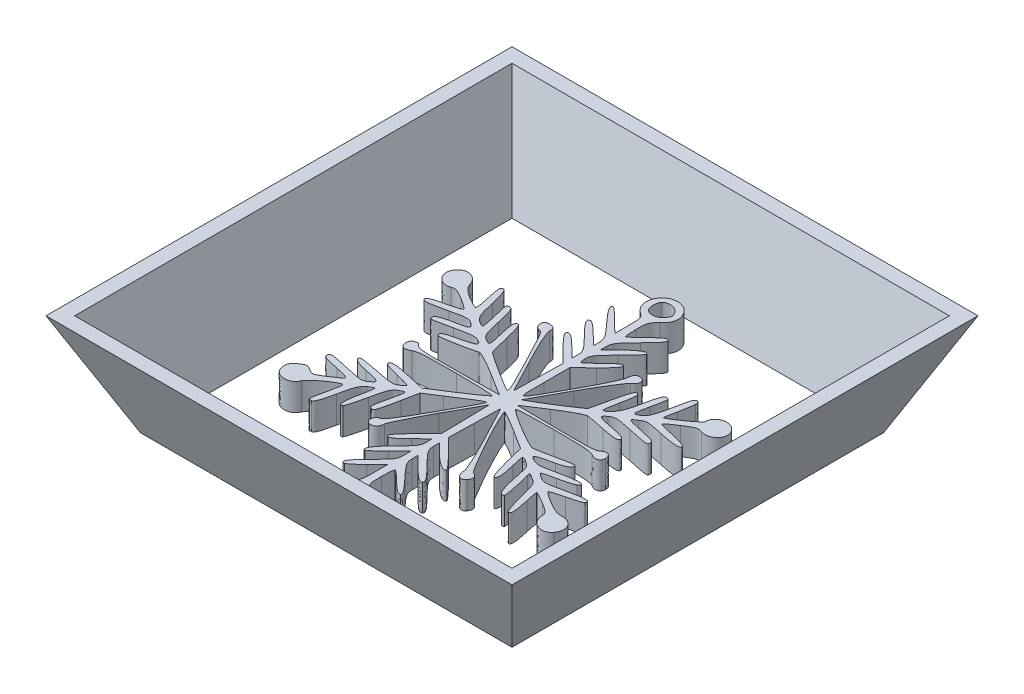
SolidWorks part; units mm, degrees
ref_plane "Front Plane" through (0, 0, 0) normal (0, 0, 1) x (1, 0, 0)
ref_plane "Top Plane" through (0, 0, 0) normal (0, 1, 0) x (1, 0, 0)
ref_plane "Right Plane" through (0, 0, 0) normal (1, 0, 0) x (0, 0, -1)
sketch "Sketch1" plane through (0, 0, 0) normal (0, 1, 0) x (1, 0, 0)
  line L0 (-0.3822, -18.6221) -> (-0.3822, -16.6296)
  line L1 (-0.3822, -16.6296) -> (-1.9112, -18.1427)
  line L2 (-0.3822, -14.2466) -> (-0.3822, -13.1888)
  line L3 (-0.3822, -13.1888) -> (-2.043, -14.8348)
  line L4 (-0.3822, -10.9399) -> (-0.3822, -10.0151)
  line L5 (-0.3822, -10.0151) -> (-1.9112, -11.5281)
  line L6 (-2.2265, -10.5198) -> (-0.3666, -8.6474)
  line L7 (-0.3666, -8.6474) -> (-0.4406, -5.0418)
  line L8 (-0.4406, -5.0418) -> (-0.5145, -1.4363)
  line L9 (-0.5145, -1.4363) -> (-3.1603, -6.2207)
  line L10 (-5.0198, -3.6827) -> (-7.1438, -5.0604)
  line L11 (-7.1438, -5.0604) -> (-7.6164, -7.3971)
  line L12 (-9.9073, -3.7762) -> (-7.6583, -4.2872)
  line L13 (-7.6583, -4.2872) -> (-4.6231, -2.3366)
  line L14 (-6.9447, 0.5136) -> (-1.0441, 0.5848)
  line L15 (-1.0441, 0.5848) -> (-4.3341, 2.6375)
  line L16 (-3.0173, 6.9386) -> (-0.5145, 2.1799)
  line L17 (-0.5145, 2.1799) -> (-0.4403, 5.7336)
  line L18 (-0.4403, 5.7336) -> (-0.3661, 9.2874)
  line L19 (-0.3661, 9.2874) -> (-2.2262, 11.16)
  line L20 (-1.9112, 12.1686) -> (-0.3822, 10.6555)
  line L21 (-0.3822, 10.6555) -> (-0.3822, 11.5803)
  line L22 (-1.9112, 15.3436) -> (-0.3822, 13.8305)
  line L23 (-0.3822, 13.8305) -> (-0.3862, 14.7483)
  line L24 (-2.043, 18.6502) -> (-0.3822, 17.0042)
  line L25 (-0.3822, 17.0042) -> (-0.3822, 18.9973)
  line L26 (0.6761, 14.7424) -> (0.6761, 13.8305)
  line L27 (0.6761, 13.8305) -> (2.2052, 15.3436)
  line L28 (2.6819, 11.2483) -> (0.6761, 9.2811)
  line L29 (0.6761, 9.2811) -> (0.6761, 5.4694)
  line L30 (4.5784, 2.503) -> (1.6095, 0.5848)
  line L31 (1.6095, 0.5848) -> (7.4, 0.5134)
  line L32 (8.0776, -7.477) -> (7.4094, -4.7314)
  line L33 (7.4094, -4.7314) -> (4.5403, -2.9206)
  line L34 (3.4446, -6.0571) -> (0.8084, -1.0575)
  line L35 (0.8084, -1.0575) -> (0.7347, -4.8531)
  line L36 (0.7347, -4.8531) -> (0.661, -8.6486)
  line L37 (0.661, -8.6486) -> (2.653, -10.6523)
  line L38 (2.2052, -11.5281) -> (0.6762, -10.0151)
  line L39 (0.6762, -10.0151) -> (0.6762, -10.927)
  line L40 (2.3932, -14.8905) -> (0.6762, -13.1888)
  line L41 (0.6762, -13.1888) -> (0.6812, -14.1072)
  spline S0 degree 3 poles (-0.941, -25.0906) (-2.4269, -24.2599) (-2.5331, -22.2048) (-1.1432, -21.1772) knots 0 0 0 0 1 1 1 1
  spline S1 degree 3 poles (-1.1432, -21.1772) (-0.4221, -20.6441) (-0.3822, -20.5101) (-0.3822, -18.6221) knots 0 0 0 0 1 1 1 1
  spline S2 degree 3 poles (-1.9112, -18.1427) (-2.7522, -18.9749) (-3.5856, -19.6558) (-3.7633, -19.6558) knots 0 0 0 0 1 1 1 1
  spline S3 degree 3 poles (-3.7633, -19.6558) (-4.4651, -19.6558) (-4.0049, -18.8993) (-2.2343, -17.1422) knots 0 0 0 0 1 1 1 1
  spline S4 degree 3 poles (-2.2343, -17.1422) (-0.5565, -15.4774) (-0.3822, -15.2048) (-0.3822, -14.2466) knots 0 0 0 0 1 1 1 1
  spline S5 degree 3 poles (-2.043, -14.8348) (-2.9564, -15.7401) (-3.7898, -16.4808) (-3.8951, -16.4808) knots 0 0 0 0 1 1 1 1
  spline S6 degree 3 poles (-3.8951, -16.4808) (-4.5456, -16.4808) (-3.8336, -15.2897) (-2.2343, -13.7027) knots 0 0 0 0 1 1 1 1
  spline S7 degree 3 poles (-2.2343, -13.7027) (-0.645, -12.1255) (-0.3822, -11.7336) (-0.3822, -10.9399) knots 0 0 0 0 1 1 1 1
  spline S8 degree 3 poles (-1.9112, -11.5281) (-3.4006, -13.0019) (-4.0864, -13.3767) (-4.0864, -12.7167) knots 0 0 0 0 1 1 1 1
  spline S9 degree 3 poles (-4.0864, -12.7167) (-4.0864, -12.5382) (-3.2494, -11.5496) (-2.2265, -10.5198) knots 0 0 0 0 1 1 1 1
  spline S10 degree 3 poles (-3.1603, -6.2207) (-4.6155, -8.8521) (-5.8062, -11.3008) (-5.8062, -11.6622) knots 0 0 0 0 1 1 1 1
  spline S11 degree 3 poles (-5.8062, -11.6622) (-5.8062, -12.4243) (-6.4599, -12.9377) (-7.1117, -12.6876) knots 0 0 0 0 1 1 1 1
  spline S12 degree 3 poles (-7.1117, -12.6876) (-7.7384, -12.4471) (-7.5495, -11.344) (-6.8645, -11.2446) knots 0 0 0 0 1 1 1 1
  spline S13 degree 3 poles (-6.8645, -11.2446) (-6.4826, -11.1891) (-5.6357, -9.9045) (-3.8218, -6.6293) knots 0 0 0 0 1 1 1 1
  spline S14 degree 3 poles (-3.8218, -6.6293) (-2.4393, -4.1332) (-1.2193, -1.8664) (-1.1105, -1.5918) knots 0 0 0 0 1 1 1 1
  spline S15 degree 3 poles (-1.1105, -1.5918) (-0.8854, -1.0236) (-1.0835, -1.1296) (-5.0198, -3.6827) knots 0 0 0 0 1 1 1 1
  spline S16 degree 3 poles (-7.6164, -7.3971) (-8.2481, -10.5206) (-8.2959, -10.6599) (-8.7344, -10.6599) knots 0 0 0 0 1 1 1 1
  spline S17 degree 3 poles (-8.7344, -10.6599) (-9.2044, -10.6599) (-9.1998, -10.1697) (-8.7113, -8.1464) knots 0 0 0 0 1 1 1 1
  spline S18 degree 3 poles (-8.7113, -8.1464) (-8.1622, -5.8722) (-8.1801, -5.785) (-9.0858, -6.3201) knots 0 0 0 0 1 1 1 1
  spline S19 degree 3 poles (-9.0858, -6.3201) (-9.7703, -6.7244) (-9.9123, -7.0565) (-10.4203, -9.4422) knots 0 0 0 0 1 1 1 1
  spline S20 degree 3 poles (-10.4203, -9.4422) (-10.7329, -10.9105) (-11.0987, -12.2218) (-11.2331, -12.3562) knots 0 0 0 0 1 1 1 1
  spline S21 degree 3 poles (-11.2331, -12.3562) (-11.7346, -12.8578) (-11.8218, -11.633) (-11.4161, -9.7841) knots 0 0 0 0 1 1 1 1
  spline S22 degree 3 poles (-11.4161, -9.7841) (-11.1876, -8.7428) (-11.0543, -7.8372) (-11.1197, -7.7717) knots 0 0 0 0 1 1 1 1
  spline S23 degree 3 poles (-11.1197, -7.7717) (-11.1852, -7.7062) (-11.5585, -7.8913) (-11.9492, -8.183) knots 0 0 0 0 1 1 1 1
  spline S24 degree 3 poles (-11.9492, -8.183) (-12.5441, -8.6272) (-12.7492, -9.1398) (-13.2117, -11.3386) knots 0 0 0 0 1 1 1 1
  spline S25 degree 3 poles (-13.2117, -11.3386) (-13.6306, -13.3299) (-13.8734, -13.985) (-14.2169, -14.0511) knots 0 0 0 0 1 1 1 1
  spline S26 degree 3 poles (-14.2169, -14.0511) (-14.7724, -14.1581) (-14.7731, -14.0928) (-14.2413, -11.7382) knots 0 0 0 0 1 1 1 1
  spline S27 degree 3 poles (-14.2413, -11.7382) (-14.0057, -10.6948) (-13.8747, -9.7793) (-13.9502, -9.7038) knots 0 0 0 0 1 1 1 1
  spline S28 degree 3 poles (-13.9502, -9.7038) (-14.2546, -9.3994) (-17.237, -11.5529) (-17.5091, -12.2736) knots 0 0 0 0 1 1 1 1
  spline S29 degree 3 poles (-17.5091, -12.2736) (-18.032, -13.659) (-20.2859, -13.552) (-20.6441, -12.1247) knots 0 0 0 0 1 1 1 1
  spline S30 degree 3 poles (-20.6441, -12.1247) (-20.8661, -11.2403) (-20.6674, -10.788) (-19.8104, -10.2264) knots 0 0 0 0 1 1 1 1
  spline S31 degree 3 poles (-19.8104, -10.2264) (-19.1374, -9.7855) (-19.0615, -9.7852) (-18.3032, -10.2205) knots 0 0 0 0 1 1 1 1
  spline S32 degree 3 poles (-18.3032, -10.2205) (-17.5062, -10.6778) (-17.5013, -10.6766) (-15.8996, -9.624) knots 0 0 0 0 1 1 1 1
  spline S33 degree 3 poles (-15.8996, -9.624) (-14.1745, -8.4904) (-14.1667, -8.5105) (-16.5219, -8.0116) knots 0 0 0 0 1 1 1 1
  spline S34 degree 3 poles (-16.5219, -8.0116) (-18.7433, -7.541) (-18.9031, -7.4779) (-18.9031, -7.0703) knots 0 0 0 0 1 1 1 1
  spline S35 degree 3 poles (-18.9031, -7.0703) (-18.9031, -6.5739) (-18.7026, -6.5856) (-15.6771, -7.2592) knots 0 0 0 0 1 1 1 1
  spline S36 degree 3 poles (-15.6771, -7.2592) (-13.2125, -7.808) (-13.0848, -7.8121) (-12.4011, -7.3641) knots 0 0 0 0 1 1 1 1
  spline S37 degree 3 poles (-12.4011, -7.3641) (-11.5117, -6.7814) (-11.7832, -6.5819) (-14.0473, -6.1547) knots 0 0 0 0 1 1 1 1
  spline S38 degree 3 poles (-14.0473, -6.1547) (-15.6309, -5.8559) (-16.5593, -5.3216) (-16.0461, -5.0045) knots 0 0 0 0 1 1 1 1
  spline S39 degree 3 poles (-16.0461, -5.0045) (-15.9158, -4.9239) (-14.6012, -5.1125) (-13.1247, -5.4235) knots 0 0 0 0 1 1 1 1
  spline S40 degree 3 poles (-13.1247, -5.4235) (-10.814, -5.9101) (-10.3477, -5.9394) (-9.7768, -5.6339) knots 0 0 0 0 1 1 1 1
  spline S41 degree 3 poles (-9.7768, -5.6339) (-9.412, -5.4386) (-9.1135, -5.1858) (-9.1135, -5.0719) knots 0 0 0 0 1 1 1 1
  spline S42 degree 3 poles (-9.1135, -5.0719) (-9.1135, -4.9581) (-10.066, -4.6603) (-11.2302, -4.4101) knots 0 0 0 0 1 1 1 1
  spline S43 degree 3 poles (-11.2302, -4.4101) (-12.5867, -4.1186) (-13.3469, -3.8289) (-13.3469, -3.6035) knots 0 0 0 0 1 1 1 1
  spline S44 degree 3 poles (-13.3469, -3.6035) (-13.3469, -3.1304) (-12.5803, -3.1689) (-9.9073, -3.7762) knots 0 0 0 0 1 1 1 1
  spline S45 degree 3 poles (-4.6231, -2.3366) (-2.9537, -1.2639) (-1.5467, -0.2626) (-1.4964, -0.1116) knots 0 0 0 0 1 1 1 1
  spline S46 degree 3 poles (-1.4964, -0.1116) (-1.435, 0.0721) (-3.2551, 0.1637) (-7.0035, 0.1654) knots 0 0 0 0 1 1 1 1
  spline S47 degree 3 poles (-7.0035, 0.1654) (-11.5126, 0.1674) (-12.7188, 0.0915) (-13.2018, -0.2249) knots 0 0 0 0 1 1 1 1
  spline S48 degree 3 poles (-13.2018, -0.2249) (-13.5316, -0.441) (-13.9968, -0.5428) (-14.2356, -0.4512) knots 0 0 0 0 1 1 1 1
  spline S49 degree 3 poles (-14.2356, -0.4512) (-14.7903, -0.2384) (-14.8017, 0.8744) (-14.2512, 1.0857) knots 0 0 0 0 1 1 1 1
  spline S50 degree 3 poles (-14.2512, 1.0857) (-13.6921, 1.3002) (-13.7066, 1.3037) (-13.2472, 0.8443) knots 0 0 0 0 1 1 1 1
  spline S51 degree 3 poles (-13.2472, 0.8443) (-12.9072, 0.5043) (-11.9361, 0.4533) (-6.9447, 0.5136) knots 0 0 0 0 1 1 1 1
  spline S52 degree 3 poles (-4.3341, 2.6375) (-6.1437, 3.7666) (-7.8104, 4.634) (-8.0381, 4.5652) knots 0 0 0 0 1 1 1 1
  spline S53 degree 3 poles (-8.0381, 4.5652) (-9.7231, 4.0559) (-13.1125, 3.4625) (-13.232, 3.6558) knots 0 0 0 0 1 1 1 1
  spline S54 degree 3 poles (-13.232, 3.6558) (-13.5202, 4.1221) (-13.0534, 4.3745) (-11.0988, 4.8094) knots 0 0 0 0 1 1 1 1
  spline S55 degree 3 poles (-11.0988, 4.8094) (-8.9999, 5.2763) (-8.6946, 5.5646) (-9.7768, 6.0577) knots 0 0 0 0 1 1 1 1
  spline S56 degree 3 poles (-9.7768, 6.0577) (-10.3069, 6.2992) (-10.958, 6.2446) (-13.0179, 5.786) knots 0 0 0 0 1 1 1 1
  spline S57 degree 3 poles (-13.0179, 5.786) (-16.0709, 5.1062) (-15.9927, 5.111) (-15.9927, 5.6017) knots 0 0 0 0 1 1 1 1
  spline S58 degree 3 poles (-15.9927, 5.6017) (-15.9927, 5.9815) (-15.0784, 6.3137) (-13.0132, 6.684) knots 0 0 0 0 1 1 1 1
  spline S59 degree 3 poles (-13.0132, 6.684) (-11.7378, 6.9127) (-11.5986, 7.1654) (-12.4429, 7.7187) knots 0 0 0 0 1 1 1 1
  spline S60 degree 3 poles (-12.4429, 7.7187) (-13.0837, 8.1385) (-13.2563, 8.1327) (-15.5033, 7.6154) knots 0 0 0 0 1 1 1 1
  spline S61 degree 3 poles (-15.5033, 7.6154) (-18.2942, 6.9728) (-18.9031, 6.9388) (-18.9031, 7.4257) knots 0 0 0 0 1 1 1 1
  spline S62 degree 3 poles (-18.9031, 7.4257) (-18.9031, 7.6594) (-18.1661, 7.9435) (-16.7864, 8.2416) knots 0 0 0 0 1 1 1 1
  spline S63 degree 3 poles (-16.7864, 8.2416) (-15.6222, 8.4931) (-14.6697, 8.7994) (-14.6697, 8.9222) knots 0 0 0 0 1 1 1 1
  spline S64 degree 3 poles (-14.6697, 8.9222) (-14.6697, 9.045) (-15.3724, 9.5722) (-16.2312, 10.094) knots 0 0 0 0 1 1 1 1
  spline S65 degree 3 poles (-16.2312, 10.094) (-17.5101, 10.8708) (-17.9098, 10.9979) (-18.4401, 10.7963) knots 0 0 0 0 1 1 1 1
  spline S66 degree 3 poles (-18.4401, 10.7963) (-19.9141, 10.2359) (-21.2641, 11.9393) (-20.396, 13.2643) knots 0 0 0 0 1 1 1 1
  spline S67 degree 3 poles (-20.396, 13.2643) (-19.5935, 14.4891) (-17.7739, 14.0482) (-17.3681, 12.5306) knots 0 0 0 0 1 1 1 1
  spline S68 degree 3 poles (-17.3681, 12.5306) (-17.2267, 12.0019) (-16.7142, 11.4962) (-15.6507, 10.836) knots 0 0 0 0 1 1 1 1
  spline S69 degree 3 poles (-15.6507, 10.836) (-14.817, 10.3185) (-14.0707, 9.9591) (-13.9924, 10.0374) knots 0 0 0 0 1 1 1 1
  spline S70 degree 3 poles (-13.9924, 10.0374) (-13.9141, 10.1157) (-14.0344, 10.9751) (-14.2599, 11.9472) knots 0 0 0 0 1 1 1 1
  spline S71 degree 3 poles (-14.2599, 11.9472) (-14.7649, 14.1248) (-14.77, 14.4754) (-14.2966, 14.4754) knots 0 0 0 0 1 1 1 1
  spline S72 degree 3 poles (-14.2966, 14.4754) (-14.0407, 14.4754) (-13.729, 13.6322) (-13.3044, 11.7915) knots 0 0 0 0 1 1 1 1
  spline S73 degree 3 poles (-13.3044, 11.7915) (-12.7892, 9.5577) (-12.564, 9.017) (-11.9621, 8.568) knots 0 0 0 0 1 1 1 1
  spline S74 degree 3 poles (-11.9621, 8.568) (-11.5642, 8.2713) (-11.1821, 8.0852) (-11.1129, 8.1544) knots 0 0 0 0 1 1 1 1
  spline S75 degree 3 poles (-11.1129, 8.1544) (-11.0437, 8.2236) (-11.1486, 8.93) (-11.346, 9.7242) knots 0 0 0 0 1 1 1 1
  spline S76 degree 3 poles (-11.346, 9.7242) (-12.0769, 12.6647) (-12.0739, 12.6233) (-11.5497, 12.6233) knots 0 0 0 0 1 1 1 1
  spline S77 degree 3 poles (-11.5497, 12.6233) (-11.1508, 12.6233) (-10.9583, 12.1409) (-10.4577, 9.8853) knots 0 0 0 0 1 1 1 1
  spline S78 degree 3 poles (-10.4577, 9.8853) (-9.9161, 7.4453) (-9.7667, 7.0982) (-9.0848, 6.6954) knots 0 0 0 0 1 1 1 1
  spline S79 degree 3 poles (-9.0848, 6.6954) (-8.1844, 6.1635) (-8.1699, 6.2365) (-8.7219, 8.5223) knots 0 0 0 0 1 1 1 1
  spline S80 degree 3 poles (-8.7219, 8.5223) (-9.2038, 10.5182) (-9.2086, 11.0358) (-8.7454, 11.0358) knots 0 0 0 0 1 1 1 1
  spline S81 degree 3 poles (-8.7454, 11.0358) (-8.4959, 11.0358) (-8.186, 10.1913) (-7.7826, 8.4121) knots 0 0 0 0 1 1 1 1
  spline S82 degree 3 poles (-7.7826, 8.4121) (-7.4554, 6.9691) (-7.115, 5.6777) (-7.0261, 5.5423) knots 0 0 0 0 1 1 1 1
  spline S83 degree 3 poles (-7.0261, 5.5423) (-6.874, 5.3105) (-2.3851, 2.4225) (-1.1471, 1.76) knots 0 0 0 0 1 1 1 1
  spline S84 degree 3 poles (-1.1471, 1.76) (-0.713, 1.5276) (-1.1645, 2.5838) (-3.0364, 6.1791) knots 0 0 0 0 1 1 1 1
  spline S85 degree 3 poles (-3.0364, 6.1791) (-5.9549, 11.7846) (-5.9814, 11.8296) (-6.3666, 11.8296) knots 0 0 0 0 1 1 1 1
  spline S86 degree 3 poles (-6.3666, 11.8296) (-6.8526, 11.8296) (-7.2846, 12.5196) (-7.0999, 13.001) knots 0 0 0 0 1 1 1 1
  spline S87 degree 3 poles (-7.0999, 13.001) (-6.9871, 13.2948) (-6.6939, 13.4184) (-6.2354, 13.3652) knots 0 0 0 0 1 1 1 1
  spline S88 degree 3 poles (-6.2354, 13.3652) (-5.6617, 13.2987) (-5.5397, 13.1473) (-5.5308, 12.491) knots 0 0 0 0 1 1 1 1
  spline S89 degree 3 poles (-5.5308, 12.491) (-5.5249, 12.0162) (-4.5146, 9.7855) (-3.0173, 6.9386) knots 0 0 0 0 1 1 1 1
  spline S90 degree 3 poles (-2.2262, 11.16) (-3.2493, 12.1899) (-4.0864, 13.1787) (-4.0864, 13.3571) knots 0 0 0 0 1 1 1 1
  spline S91 degree 3 poles (-4.0864, 13.3571) (-4.0864, 14.0171) (-3.4005, 13.6423) (-1.9112, 12.1686) knots 0 0 0 0 1 1 1 1
  spline S92 degree 3 poles (-0.3822, 11.5803) (-0.3822, 12.374) (-0.645, 12.766) (-2.2343, 14.3431) knots 0 0 0 0 1 1 1 1
  spline S93 degree 3 poles (-2.2343, 14.3431) (-4.0049, 16.1002) (-4.4651, 16.8566) (-3.7633, 16.8566) knots 0 0 0 0 1 1 1 1
  spline S94 degree 3 poles (-3.7633, 16.8566) (-3.5856, 16.8566) (-2.7522, 16.1758) (-1.9112, 15.3436) knots 0 0 0 0 1 1 1 1
  spline S95 degree 3 poles (-0.3862, 14.7483) (-0.3892, 15.5155) (-0.6927, 15.9915) (-2.2343, 17.6504) knots 0 0 0 0 1 1 1 1
  spline S96 degree 3 poles (-2.2343, 17.6504) (-3.8968, 19.4393) (-4.4347, 20.2962) (-3.8951, 20.2962) knots 0 0 0 0 1 1 1 1
  spline S97 degree 3 poles (-3.8951, 20.2962) (-3.7898, 20.2962) (-2.9564, 19.5555) (-2.043, 18.6502) knots 0 0 0 0 1 1 1 1
  spline S98 degree 3 poles (-0.3822, 18.9973) (-0.3822, 20.8919) (-0.4203, 21.0187) (-1.1529, 21.5603) knots 0 0 0 0 1 1 1 1
  spline S99 degree 3 poles (-1.1529, 21.5603) (-2.121, 22.276) (-2.4045, 23.433) (-1.8667, 24.473) knots 0 0 0 0 1 1 1 1
  spline S100 degree 3 poles (-1.8667, 24.473) (-1.0838, 25.9868) (0.9567, 26.1914) (2.0032, 24.861) knots 0 0 0 0 1 1 1 1
  spline S101 degree 3 poles (2.0032, 24.861) (2.8204, 23.8222) (2.6834, 22.754) (1.6022, 21.7343) knots 0 0 0 0 1 1 1 1
  spline S102 degree 3 poles (1.6022, 21.7343) (0.7265, 20.9084) (0.6761, 20.7664) (0.6761, 19.1234) knots 0 0 0 0 1 1 1 1
  spline S103 degree 3 poles (0.6761, 19.1234) (0.6761, 18.1677) (0.762, 17.3858) (0.8669, 17.3858) knots 0 0 0 0 1 1 1 1
  spline S104 degree 3 poles (0.8669, 17.3858) (0.9718, 17.3858) (1.7446, 18.0656) (2.5842, 18.8964) knots 0 0 0 0 1 1 1 1
  spline S105 degree 3 poles (2.5842, 18.8964) (3.7872, 20.0869) (4.1793, 20.3385) (4.4342, 20.0835) knots 0 0 0 0 1 1 1 1
  spline S106 degree 3 poles (4.4342, 20.0835) (4.6892, 19.8286) (4.3253, 19.325) (2.7169, 17.7072) knots 0 0 0 0 1 1 1 1
  spline S107 degree 3 poles (2.7169, 17.7072) (0.9641, 15.944) (0.6761, 15.5256) (0.6761, 14.7424) knots 0 0 0 0 1 1 1 1
  spline S108 degree 3 poles (2.2052, 15.3436) (3.5521, 16.6764) (4.6449, 17.2623) (4.6449, 16.6516) knots 0 0 0 0 1 1 1 1
  spline S109 degree 3 poles (4.6449, 16.6516) (4.6449, 16.5388) (3.7519, 15.5595) (2.6605, 14.4754) knots 0 0 0 0 1 1 1 1
  spline S110 degree 3 poles (2.6605, 14.4754) (0.9962, 12.8222) (0.6761, 12.3645) (0.6761, 11.6377) knots 0 0 0 0 1 1 1 1
  spline S111 degree 3 poles (0.6761, 11.6377) (0.6761, 11.1612) (0.762, 10.7712) (0.8669, 10.7712) knots 0 0 0 0 1 1 1 1
  spline S112 degree 3 poles (0.8669, 10.7712) (0.9718, 10.7712) (1.7446, 11.451) (2.5842, 12.2818) knots 0 0 0 0 1 1 1 1
  spline S113 degree 3 poles (2.5842, 12.2818) (3.6863, 13.3724) (4.1909, 13.7122) (4.3992, 13.5039) knots 0 0 0 0 1 1 1 1
  spline S114 degree 3 poles (4.3992, 13.5039) (4.6075, 13.2957) (4.13, 12.6685) (2.6819, 11.2483) knots 0 0 0 0 1 1 1 1
  spline S115 degree 3 poles (0.6761, 5.4694) (0.6761, 1.033) (0.3697, 0.8857) (3.7251, 6.9348) knots 0 0 0 0 1 1 1 1
  spline S116 degree 3 poles (3.7251, 6.9348) (5.1304, 9.4682) (6.1319, 11.5931) (6.219, 12.2264) knots 0 0 0 0 1 1 1 1
  spline S117 degree 3 poles (6.219, 12.2264) (6.3448, 13.1401) (6.4551, 13.2848) (7.0261, 13.2848) knots 0 0 0 0 1 1 1 1
  spline S118 degree 3 poles (7.0261, 13.2848) (7.947, 13.2848) (8.0651, 12.3156) (7.2122, 11.7568) knots 0 0 0 0 1 1 1 1
  spline S119 degree 3 poles (7.2122, 11.7568) (6.8554, 11.5231) (5.4431, 9.2779) (3.9836, 6.6245) knots 0 0 0 0 1 1 1 1
  spline S120 degree 3 poles (3.9836, 6.6245) (2.5567, 4.0302) (1.3267, 1.7957) (1.2504, 1.6587) knots 0 0 0 0 1 1 1 1
  spline S121 degree 3 poles (1.2504, 1.6587) (1.0807, 1.3543) (5.7659, 4.2454) (7.2304, 5.3488) knots 0 0 0 0 1 1 1 1
  spline S122 degree 3 poles (7.2304, 5.3488) (7.27, 5.3786) (7.5518, 6.5811) (7.8568, 8.0209) knots 0 0 0 0 1 1 1 1
  spline S123 degree 3 poles (7.8568, 8.0209) (8.432, 10.7374) (8.6934, 11.3268) (9.1291, 10.8903) knots 0 0 0 0 1 1 1 1
  spline S124 degree 3 poles (9.1291, 10.8903) (9.2873, 10.7318) (9.2001, 9.8322) (8.8932, 8.4561) knots 0 0 0 0 1 1 1 1
  spline S125 degree 3 poles (8.8932, 8.4561) (8.6254, 7.2556) (8.5059, 6.2733) (8.6275, 6.2733) knots 0 0 0 0 1 1 1 1
  spline S126 degree 3 poles (8.6275, 6.2733) (9.297, 6.2733) (10.1558, 7.581) (10.4521, 9.0514) knots 0 0 0 0 1 1 1 1
  spline S127 degree 3 poles (10.4521, 9.0514) (11.0302, 11.9204) (11.2691, 12.6233) (11.6665, 12.6233) knots 0 0 0 0 1 1 1 1
  spline S128 degree 3 poles (11.6665, 12.6233) (12.1506, 12.6233) (12.1485, 12.4854) (11.6308, 10.2095) knots 0 0 0 0 1 1 1 1
  spline S129 degree 3 poles (11.6308, 10.2095) (11.3986, 9.1882) (11.2758, 8.2854) (11.358, 8.2032) knots 0 0 0 0 1 1 1 1
  spline S130 degree 3 poles (11.358, 8.2032) (11.4402, 8.121) (11.7956, 8.2425) (12.1477, 8.4732) knots 0 0 0 0 1 1 1 1
  spline S131 degree 3 poles (12.1477, 8.4732) (12.7653, 8.8779) (13.0645, 9.8066) (13.8044, 13.6155) knots 0 0 0 0 1 1 1 1
  spline S132 degree 3 poles (13.8044, 13.6155) (13.993, 14.5867) (14.7041, 14.7992) (14.6897, 13.8801) knots 0 0 0 0 1 1 1 1
  spline S133 degree 3 poles (14.6897, 13.8801) (14.6847, 13.5527) (14.5148, 12.512) (14.3123, 11.5675) knots 0 0 0 0 1 1 1 1
  spline S134 degree 3 poles (14.3123, 11.5675) (14.1099, 10.623) (13.9679, 9.8267) (13.9967, 9.7978) knots 0 0 0 0 1 1 1 1
  spline S135 degree 3 poles (13.9967, 9.7978) (14.1875, 9.607) (17.6094, 12.0368) (17.6094, 12.3631) knots 0 0 0 0 1 1 1 1
  spline S136 degree 3 poles (17.6094, 12.3631) (17.6094, 13.7742) (19.4839, 14.453) (20.5198, 13.4171) knots 0 0 0 0 1 1 1 1
  spline S137 degree 3 poles (20.5198, 13.4171) (21.8116, 12.1253) (20.3883, 10.2111) (18.5997, 10.8346) knots 0 0 0 0 1 1 1 1
  spline S138 degree 3 poles (18.5997, 10.8346) (17.9691, 11.0544) (17.648, 10.9484) (16.2855, 10.0706) knots 0 0 0 0 1 1 1 1
  spline S139 degree 3 poles (16.2855, 10.0706) (15.4155, 9.5101) (14.7026, 8.9824) (14.7013, 8.8981) knots 0 0 0 0 1 1 1 1
  spline S140 degree 3 poles (14.7013, 8.8981) (14.7003, 8.8136) (15.6475, 8.5409) (16.8068, 8.2917) knots 0 0 0 0 1 1 1 1
  spline S141 degree 3 poles (16.8068, 8.2917) (17.9662, 8.0426) (18.9858, 7.7238) (19.0726, 7.5833) knots 0 0 0 0 1 1 1 1
  spline S142 degree 3 poles (19.0726, 7.5833) (19.4037, 7.0476) (18.3587, 7.0479) (15.8834, 7.5842) knots 0 0 0 0 1 1 1 1
  spline S143 degree 3 poles (15.8834, 7.5842) (13.3243, 8.1386) (13.315, 8.1387) (12.493, 7.6183) knots 0 0 0 0 1 1 1 1
  spline S144 degree 3 poles (12.493, 7.6183) (11.576, 7.0376) (11.5918, 7.0255) (13.9052, 6.5354) knots 0 0 0 0 1 1 1 1
  spline S145 degree 3 poles (13.9052, 6.5354) (16.1267, 6.0648) (16.2865, 6.0016) (16.2865, 5.594) knots 0 0 0 0 1 1 1 1
  spline S146 degree 3 poles (16.2865, 5.594) (16.2865, 5.109) (16.2707, 5.11) (13.1284, 5.7791) knots 0 0 0 0 1 1 1 1
  spline S147 degree 3 poles (13.1284, 5.7791) (10.5871, 6.3202) (10.4505, 6.3242) (9.7703, 5.8786) knots 0 0 0 0 1 1 1 1
  spline S148 degree 3 poles (9.7703, 5.8786) (8.8898, 5.3017) (9.1343, 5.1423) (11.5934, 4.6895) knots 0 0 0 0 1 1 1 1
  spline S149 degree 3 poles (11.5934, 4.6895) (12.5775, 4.5083) (13.4541, 4.2444) (13.5415, 4.103) knots 0 0 0 0 1 1 1 1
  spline S150 degree 3 poles (13.5415, 4.103) (13.9215, 3.4883) (13.1012, 3.4225) (10.9948, 3.899) knots 0 0 0 0 1 1 1 1
  spline S151 degree 3 poles (10.9948, 3.899) (9.7579, 4.1788) (8.4762, 4.4107) (8.1465, 4.4145) knots 0 0 0 0 1 1 1 1
  spline S152 degree 3 poles (8.1465, 4.4145) (7.8169, 4.4185) (6.2112, 3.5581) (4.5784, 2.503) knots 0 0 0 0 1 1 1 1
  spline S153 degree 3 poles (7.4, 0.5134) (12.3182, 0.4527) (13.2585, 0.5034) (13.6419, 0.8505) knots 0 0 0 0 1 1 1 1
  spline S154 degree 3 poles (13.6419, 0.8505) (14.2303, 1.383) (14.9636, 1.0888) (14.9636, 0.3202) knots 0 0 0 0 1 1 1 1
  spline S155 degree 3 poles (14.9636, 0.3202) (14.9636, -0.4608) (14.258, -0.7245) (13.499, -0.2272) knots 0 0 0 0 1 1 1 1
  spline S156 degree 3 poles (13.499, -0.2272) (13.0219, 0.0854) (11.8091, 0.1638) (7.4324, 0.1649) knots 0 0 0 0 1 1 1 1
  spline S157 degree 3 poles (7.4324, 0.1649) (4.2549, 0.1657) (1.9976, 0.0652) (2.0467, -0.0748) knots 0 0 0 0 1 1 1 1
  spline S158 degree 3 poles (2.0467, -0.0748) (2.2114, -0.5442) (7.6113, -3.7808) (8.2297, -3.7808) knots 0 0 0 0 1 1 1 1
  spline S159 degree 3 poles (8.2297, -3.7808) (8.5751, -3.7808) (9.8913, -3.5398) (11.1546, -3.2453) knots 0 0 0 0 1 1 1 1
  spline S160 degree 3 poles (11.1546, -3.2453) (12.4179, -2.9507) (13.5087, -2.767) (13.5787, -2.837) knots 0 0 0 0 1 1 1 1
  spline S161 degree 3 poles (13.5787, -2.837) (13.9651, -3.2234) (13.2439, -3.7244) (11.8815, -4.0161) knots 0 0 0 0 1 1 1 1
  spline S162 degree 3 poles (11.8815, -4.0161) (9.065, -4.6192) (8.8623, -4.7705) (10.1089, -5.3384) knots 0 0 0 0 1 1 1 1
  spline S163 degree 3 poles (10.1089, -5.3384) (10.6877, -5.6022) (11.245, -5.5591) (13.2946, -5.0922) knots 0 0 0 0 1 1 1 1
  spline S164 degree 3 poles (13.2946, -5.0922) (15.8756, -4.5042) (17.1212, -4.5544) (16.2304, -5.2106) knots 0 0 0 0 1 1 1 1
  spline S165 degree 3 poles (16.2304, -5.2106) (15.9813, -5.3941) (14.9395, -5.7024) (13.9153, -5.8956) knots 0 0 0 0 1 1 1 1
  spline S166 degree 3 poles (13.9153, -5.8956) (12.8911, -6.0888) (12.0532, -6.3212) (12.0532, -6.4121) knots 0 0 0 0 1 1 1 1
  spline S167 degree 3 poles (12.0532, -6.4121) (12.0532, -6.5029) (12.3806, -6.7701) (12.7808, -7.0059) knots 0 0 0 0 1 1 1 1
  spline S168 degree 3 poles (12.7808, -7.0059) (13.4614, -7.4068) (13.6792, -7.3957) (16.1542, -6.8327) knots 0 0 0 0 1 1 1 1
  spline S169 degree 3 poles (16.1542, -6.8327) (18.6336, -6.2687) (19.4763, -6.2897) (19.0954, -6.906) knots 0 0 0 0 1 1 1 1
  spline S170 degree 3 poles (19.0954, -6.906) (19.0067, -7.0495) (18.0408, -7.3656) (16.9489, -7.6085) knots 0 0 0 0 1 1 1 1
  spline S171 degree 3 poles (16.9489, -7.6085) (15.857, -7.8515) (14.9649, -8.1314) (14.9665, -8.2306) knots 0 0 0 0 1 1 1 1
  spline S172 degree 3 poles (14.9665, -8.2306) (14.9685, -8.3298) (15.6848, -8.8538) (16.5591, -9.395) knots 0 0 0 0 1 1 1 1
  spline S173 degree 3 poles (16.5591, -9.395) (17.7013, -10.1019) (18.4196, -10.3687) (19.1107, -10.3428) knots 0 0 0 0 1 1 1 1
  spline S174 degree 3 poles (19.1107, -10.3428) (20.6994, -10.283) (21.5262, -11.713) (20.6371, -12.9824) knots 0 0 0 0 1 1 1 1
  spline S175 degree 3 poles (20.6371, -12.9824) (19.7143, -14.2999) (17.6184, -13.4316) (17.6036, -11.7256) knots 0 0 0 0 1 1 1 1
  spline S176 degree 3 poles (17.6036, -11.7256) (17.5986, -11.1906) (17.2706, -10.8608) (15.9608, -10.076) knots 0 0 0 0 1 1 1 1
  spline S177 degree 3 poles (15.9608, -10.076) (15.0603, -9.5365) (14.2864, -9.1323) (14.2409, -9.1778) knots 0 0 0 0 1 1 1 1
  spline S178 degree 3 poles (14.2409, -9.1778) (14.1954, -9.2233) (14.3376, -10.0219) (14.5569, -10.9525) knots 0 0 0 0 1 1 1 1
  spline S179 degree 3 poles (14.5569, -10.9525) (15.0503, -13.0456) (15.0738, -13.9152) (14.6328, -13.7707) knots 0 0 0 0 1 1 1 1
  spline S180 degree 3 poles (14.6328, -13.7707) (14.4509, -13.7111) (14.0045, -12.4457) (13.6407, -10.9587) knots 0 0 0 0 1 1 1 1
  spline S181 degree 3 poles (13.6407, -10.9587) (13.0345, -8.4812) (12.9046, -8.2081) (12.0867, -7.6911) knots 0 0 0 0 1 1 1 1
  spline S182 degree 3 poles (12.0867, -7.6911) (11.2361, -7.1537) (11.2016, -7.1511) (11.3516, -7.6368) knots 0 0 0 0 1 1 1 1
  spline S183 degree 3 poles (11.3516, -7.6368) (11.7605, -8.96) (12.3293, -11.7949) (12.2099, -11.9144) knots 0 0 0 0 1 1 1 1
  spline S184 degree 3 poles (12.2099, -11.9144) (11.7731, -12.3512) (11.3076, -11.5169) (10.8981, -9.5634) knots 0 0 0 0 1 1 1 1
  spline S185 degree 3 poles (10.8981, -9.5634) (10.6433, -8.3475) (10.3776, -7.155) (10.3076, -6.9133) knots 0 0 0 0 1 1 1 1
  spline S186 degree 3 poles (10.3076, -6.9133) (10.1724, -6.4462) (8.9172, -5.5057) (8.7081, -5.7148) knots 0 0 0 0 1 1 1 1
  spline S187 degree 3 poles (8.7081, -5.7148) (8.6398, -5.7831) (8.7692, -6.5539) (8.9956, -7.4277) knots 0 0 0 0 1 1 1 1
  spline S188 degree 3 poles (8.9956, -7.4277) (9.5004, -9.3758) (9.5312, -10.4801) (9.0766, -10.3311) knots 0 0 0 0 1 1 1 1
  spline S189 degree 3 poles (9.0766, -10.3311) (8.8947, -10.2715) (8.4452, -8.9871) (8.0776, -7.477) knots 0 0 0 0 1 1 1 1
  spline S190 degree 3 poles (4.5403, -2.9206) (2.9624, -1.9248) (1.6142, -1.167) (1.5444, -1.2368) knots 0 0 0 0 1 1 1 1
  spline S191 degree 3 poles (1.5444, -1.2368) (1.2909, -1.4903) (6.5585, -11.173) (7.0317, -11.3232) knots 0 0 0 0 1 1 1 1
  spline S192 degree 3 poles (7.0317, -11.3232) (7.689, -11.5318) (7.8522, -12.1036) (7.4203, -12.6848) knots 0 0 0 0 1 1 1 1
  spline S193 degree 3 poles (7.4203, -12.6848) (6.9105, -13.3708) (6.1033, -12.8468) (6.0904, -11.8214) knots 0 0 0 0 1 1 1 1
  spline S194 degree 3 poles (6.0904, -11.8214) (6.0844, -11.3783) (4.9721, -8.9541) (3.4446, -6.0571) knots 0 0 0 0 1 1 1 1
  spline S195 degree 3 poles (2.653, -10.6523) (3.7485, -11.7544) (4.6449, -12.7427) (4.6449, -12.8486) knots 0 0 0 0 1 1 1 1
  spline S196 degree 3 poles (4.6449, -12.8486) (4.6449, -13.4475) (3.541, -12.8496) (2.2052, -11.5281) knots 0 0 0 0 1 1 1 1
  spline S197 degree 3 poles (0.6762, -10.927) (0.6762, -11.7102) (0.9641, -12.1285) (2.717, -13.8917) knots 0 0 0 0 1 1 1 1
  spline S198 degree 3 poles (2.717, -13.8917) (4.3264, -15.5107) (4.6893, -16.013) (4.434, -16.2684) knots 0 0 0 0 1 1 1 1
  spline S199 degree 3 poles (4.434, -16.2684) (4.1786, -16.5238) (3.7472, -16.2325) (2.3932, -14.8905) knots 0 0 0 0 1 1 1 1
  spline S200 degree 3 poles (0.6812, -14.1072) (0.6852, -14.8847) (0.9911, -15.3472) (2.6729, -17.1216) knots 0 0 0 0 1 1 1 1
  spline S201 degree 3 poles (2.6729, -17.1216) (4.0452, -18.5694) (4.5748, -19.3026) (4.3852, -19.4921) knots 0 0 0 0 1 1 1 1
  spline S202 degree 3 poles (4.3852, -19.4921) (4.1956, -19.6817) (3.6386, -19.2994) (2.5842, -18.256) knots 0 0 0 0 1 1 1 1
  spline S203 degree 3 poles (2.5842, -18.256) (1.7446, -17.4252) (0.9718, -16.7454) (0.8669, -16.7454) knots 0 0 0 0 1 1 1 1
  spline S204 degree 3 poles (0.8669, -16.7454) (0.7619, -16.7454) (0.6761, -17.5868) (0.6761, -18.6152) knots 0 0 0 0 1 1 1 1
  spline S205 degree 3 poles (0.6761, -18.6152) (0.6761, -20.4095) (0.7136, -20.5204) (1.6022, -21.3585) knots 0 0 0 0 1 1 1 1
  spline S206 degree 3 poles (1.6022, -21.3585) (2.2705, -21.9888) (2.5282, -22.4583) (2.5282, -23.0457) knots 0 0 0 0 1 1 1 1
  spline S207 degree 3 poles (2.5282, -23.0457) (2.5282, -24.7342) (0.5293, -25.9124) (-0.941, -25.0906) knots 0 0 0 0 1 1 1 1
  spline S208 degree 3 poles (1.3619, -23.7568) (1.7634, -23.1441) (1.7634, -23.0466) (1.3619, -22.4339) knots 0 0 0 0 1 1 1 1
  spline S209 degree 3 poles (1.3619, -22.4339) (0.8897, -21.7132) (-0.2978, -21.5292) (-0.8584, -22.0899) knots 0 0 0 0 1 1 1 1
  spline S210 degree 3 poles (-0.8584, -22.0899) (-1.2677, -22.4992) (-1.2677, -23.6915) (-0.8584, -24.1008) knots 0 0 0 0 1 1 1 1
  spline S211 degree 3 poles (-0.8584, -24.1008) (-0.2978, -24.6615) (0.8897, -24.4775) (1.3619, -23.7568) knots 0 0 0 0 1 1 1 1
  spline S212 degree 3 poles (19.8584, -11.9829) (19.8584, -11.2286) (19.0233, -10.9088) (18.771, -11.5664) knots 0 0 0 0 1 1 1 1
  spline S213 degree 3 poles (18.771, -11.5664) (18.5303, -12.1937) (18.8709, -12.8273) (19.3946, -12.7264) knots 0 0 0 0 1 1 1 1
  spline S214 degree 3 poles (19.3946, -12.7264) (19.6875, -12.67) (19.8584, -12.396) (19.8584, -11.9829) knots 0 0 0 0 1 1 1 1
  spline S215 degree 3 poles (-18.426, -11.6184) (-18.4758, -11.2693) (-18.7314, -11.0248) (-19.1015, -10.9723) knots 0 0 0 0 1 1 1 1
  spline S216 degree 3 poles (-19.1015, -10.9723) (-19.5819, -10.9041) (-19.6968, -11.0147) (-19.6968, -11.5455) knots 0 0 0 0 1 1 1 1
  spline S217 degree 3 poles (-19.6968, -11.5455) (-19.6968, -11.9073) (-19.548, -12.2553) (-19.3661, -12.3187) knots 0 0 0 0 1 1 1 1
  spline S218 degree 3 poles (-19.3661, -12.3187) (-18.7819, -12.5225) (-18.3436, -12.1961) (-18.426, -11.6184) knots 0 0 0 0 1 1 1 1
  spline S219 degree 3 poles (-18.5061, 12.3588) (-18.5061, 13.113) (-19.3412, 13.4328) (-19.5936, 12.7752) knots 0 0 0 0 1 1 1 1
  spline S220 degree 3 poles (-19.5936, 12.7752) (-19.8343, 12.1479) (-19.4937, 11.5144) (-18.97, 11.6153) knots 0 0 0 0 1 1 1 1
  spline S221 degree 3 poles (-18.97, 11.6153) (-18.6771, 11.6717) (-18.5061, 11.9457) (-18.5061, 12.3588) knots 0 0 0 0 1 1 1 1
  spline S222 degree 3 poles (19.8585, 12.3588) (19.8585, 13.113) (19.0234, 13.4328) (18.771, 12.7752) knots 0 0 0 0 1 1 1 1
  spline S223 degree 3 poles (18.771, 12.7752) (18.5303, 12.1479) (18.8709, 11.5144) (19.3947, 11.6153) knots 0 0 0 0 1 1 1 1
  spline S224 degree 3 poles (19.3947, 11.6153) (19.6875, 11.6717) (19.8585, 11.9457) (19.8585, 12.3588) knots 0 0 0 0 1 1 1 1
  spline S225 degree 3 poles (1.3619, 22.8098) (1.7634, 23.4226) (1.7634, 23.52) (1.3619, 24.1328) knots 0 0 0 0 1 1 1 1
  spline S226 degree 3 poles (1.3619, 24.1328) (0.8897, 24.8535) (-0.2977, 25.0374) (-0.8584, 24.4767) knots 0 0 0 0 1 1 1 1
  spline S227 degree 3 poles (-0.8584, 24.4767) (-1.2677, 24.0674) (-1.2677, 22.8752) (-0.8584, 22.4659) knots 0 0 0 0 1 1 1 1
  spline S228 degree 3 poles (-0.8584, 22.4659) (-0.2977, 21.9052) (0.8897, 22.0891) (1.3619, 22.8098) knots 0 0 0 0 1 1 1 1
extrude "Boss-Extrude1" add sketch "Sketch1" against normal blind 4 contours S44 L12 L13 S45 S46 S47 S48 S49 S50 S51 L14 L15 S52 S53 S54 S55 S56 S57 S58 S59 S60 S61 S62 S63 S64 S65 S66 S67 S68 S69 S70 S71 S72 S73 S74 S75 S76 S77 S78 S79 S80 S81 S82 S83 S84 S85 S86 S87 S88 S89 L16 L17 L18 L19 S90 S91 L20 L21 S92 S93 S94 L22 L23 S95 S96 S97 L24 L25 S98 S99 S100 S101 S102 S103 S104 S105 S106 S107 L26 L27 S108 S109 S110 S111 S112 S113 S114 L28 L29 S115 S116 S117 S118 S119 S120 S121 S122 S123 S124 S125 S126 S127 S128 S129 S130 S131 S132 S133 S134 S135 S136 S137 S138 S139 S140 S141 S142 S143 S144 S145 S146 S147 S148 S149 S150 S151 S152 L30 L31 S153 S154 S155 S156 S157 S158 S159 S160 S161 S162 S163 S164 S165 S166 S167 S168 S169 S170 S171 S172 S173 S174 S175 S176 S177 S178 S179 S180 S181 S182 S183 S184 S185 S186 S187 S188 S189 L32 L33 S190 S191 S192 S193 S194 L34 L35 L36 L37 S195 S196 L38 L39 S197 S198 S199 L40 L41 S200 S201 S202 S203 S204 S205 S206 S207 S0 S1 L0 L1 S2 S3 S4 L2 L3 S5 S6 S7 L4 L5 S8 S9 L6 L7 L8 L9 S10 S11 S12 S13 S14 S15 L10 L11 S16 S17 S18 S19 S20 S21 S22 S23 S24 S25 S26 S27 S28 S29 S30 S31 S32 S33 S34 S35 S36 S37 S38 S39 S40 S41 S42 S43 | S227 S228 S225 S226
other "Join1"
other "6th (3D Design)<1>@Assembling (5th and 6th)"
